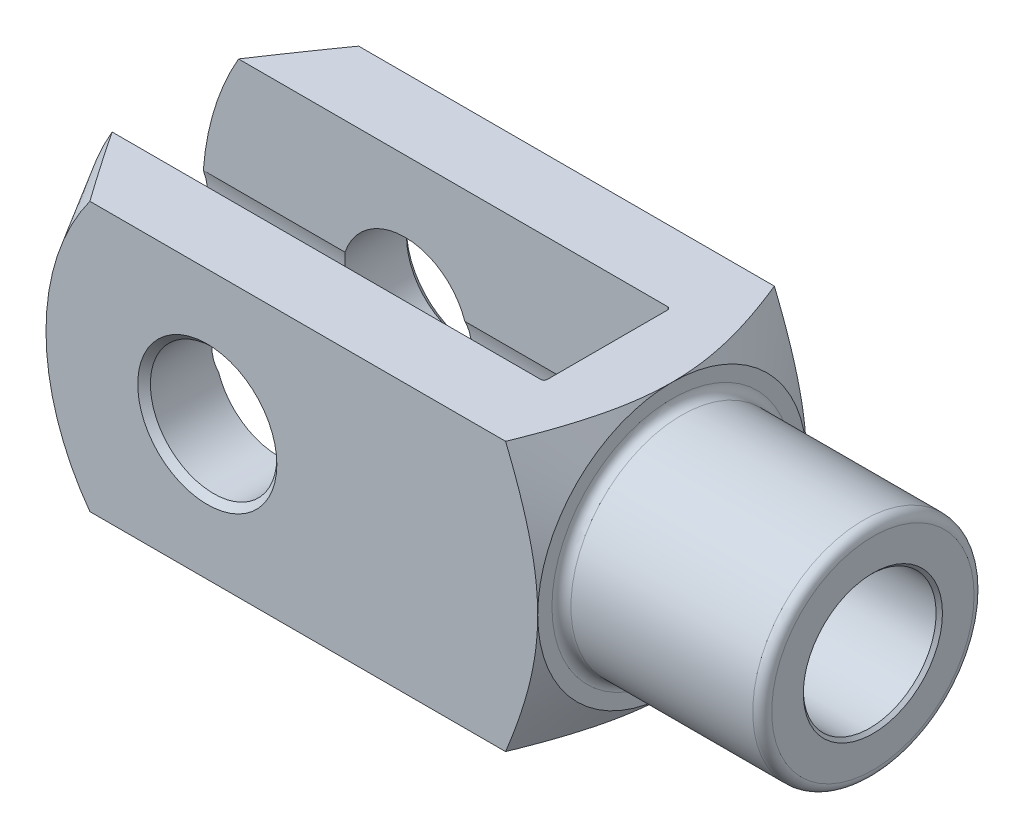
SolidWorks part; units mm, degrees
ref_plane "Front Plane" through (0, 0, 0) normal (0, 0, 1) x (1, 0, 0)
ref_plane "Top Plane" through (0, 0, 0) normal (0, 1, 0) x (1, 0, 0)
ref_plane "Right Plane" through (0, 0, 0) normal (1, 0, 0) x (0, 0, -1)
sketch "Sketch1" plane through (0, 0, 0) normal (1, 0, 0) x (0, 0, -1)
  line L0 (0, 0) -> (0, 50000) construction
  line L1 (0, 0) -> (50000, 0) construction
  line L2 (-42.5, -42.5) -> (-42.5, 42.5)
  line L3 (-42.5, 42.5) -> (42.5, 42.5)
  line L4 (42.5, -42.5) -> (42.5, 42.5)
  line L5 (-42.5, -42.5) -> (42.5, -42.5)
  point P9 (0, 42.5)
  point P11 (42.5, 0)
  point P12 (-42.5, 0)
  dimension "D1" = 85
  dimension "D2" = 85
extrude "Extrude1" add sketch "Sketch1" against normal blind 232
sketch "Sketch2" plane through (0, 0, 0) normal (1, 0, 0) x (0, 0, -1)
  circle A0 centre (0, 0) radius 35
  circle A1 centre (0, 0) radius 70
  dimension "D1" = 70
  dimension "D2" = 140
extrude "Extrude2" cut sketch "Sketch2" against normal blind 63.5
sketch "Sketch3" plane through (0, 0, 42.5) normal (0, 0, 1) x (1, 0, 0)
  circle A0 centre (-168, 0) radius 20
  dimension "D1" = 40
  dimension "D2" = 168
extrude "Extrude3" cut sketch "Sketch3" against normal through all
sketch "Sketch4" plane through (0, 42.5, 0) normal (0, 1, 0) x (1, 0, 0)
  line L0 (0, 0) -> (-50000, 0) construction
  line L1 (-232, -20) -> (-232, 20)
  line L2 (-232, 42.5) -> (-232, -42.5) construction
  line L3 (-232, 20) -> (-84, 20)
  line L4 (-84, 20) -> (-84, -20)
  line L5 (-168, 42.5) -> (-168, -42.5) construction
  line L6 (-232, -20) -> (-84, -20)
  point P7 (-168, 0)
  point P13 (-84, 0)
  point P14 (-232, 0)
  dimension "D1" = 84
  dimension "D2" = 40
extrude "Extrude4" cut sketch "Sketch4" against normal through all
fillet "Fillet1" radius 1 2 edges at (-84, 0, 20) (-84, 0, -20)
fillet "Fillet2" radius 3 2 edges at (0, 0, -35) (-63.5, 0, -35)
chamfer "Chamfer2" distance 2 angle 45 2 edges at (-148, 0, -42.5) (-148, 0, 42.5)
sketch "Sketch6" plane through (0, 0, 0) normal (0, 0, 1) x (1, 0, 0)
  line L0 (-63.5, -42.5) -> (-63.5, -85)
  line L1 (-63.5, -85) -> (-88.0374, -85)
  line L2 (-88.0374, -85) -> (-63.5, -42.5)
  dimension "D1" = 30
  dimension "D2" = 85
revolve "Cut-Revolve1" cut sketch "Sketch6" angle 360 about axis through (-63.5, 0, 0) along (1, 0, 0)
sketch "Sketch7" plane through (0, 0, 0) normal (0, 1, 0) x (1, 0, 0)
  line L0 (-219.0096, -42.5) -> (-232, -20)
  line L1 (-232, 20) -> (-219.0096, 42.5)
  line L2 (-219.0096, 42.5) -> (-317, 42.5)
  line L3 (-232, 20) -> (-232, -20)
  line L4 (-317, 42.5) -> (-317, -42.5)
  line L5 (-317, -42.5) -> (-219.0096, -42.5)
  line L6 (-232, 42.5) -> (-73.6637, 42.5) construction
  line L7 (-232, -42.5) -> (-73.6637, -42.5) construction
  line L8 (-147, 0.6162) -> (-147, 50000.6162) construction
  dimension "D1" = 120
  dimension "D2" = 85
  dimension "D3" = 85
revolve "Cut-Revolve2" cut sketch "Sketch7" angle 180 about L8
sketch "Sketch8" plane through (0, 0, 0) normal (1, 0, 0) x (0, 0, -1)
  circle A0 centre (0, 0) radius 21
  dimension "D1" = 42
extrude "Extrude5" cut sketch "Sketch8" against normal through all
chamfer "Chamfer3" distance 1 angle 45 1 edges at (0, 0, -21)
equation "\"D2@Sketch1\" = \"D1@Sketch1\""
equation "\"D2@Sketch2\" = \"D1@Sketch2\"*2"
equation "\"D2@Sketch6\" = \"D1@Sketch1\""
equation "\"D2@Sketch7\" = \"D1@Sketch1\""
equation "\"D3@Sketch7\" = \"D1@Sketch1\""
